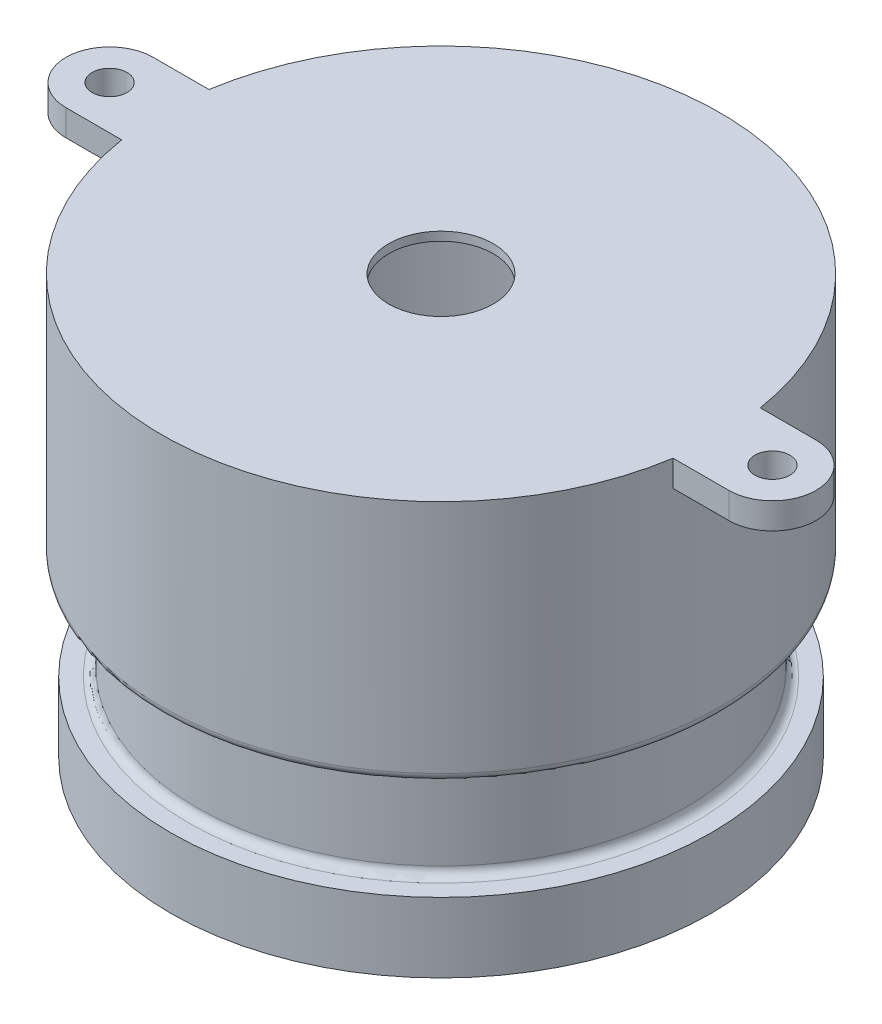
SolidWorks part; units mm, degrees
ref_plane "Front" through (0, 0, 0) normal (0, 0, 1) x (1, 0, 0)
ref_plane "Top" through (0, 0, 0) normal (0, 1, 0) x (1, 0, 0)
ref_plane "Right" through (0, 0, 0) normal (1, 0, 0) x (0, 0, -1)
sketch "Sketch1" plane through (0, 0, 0) normal (0, 0, 1) x (1, 0, 0)
  line L0 (0, 0) -> (0, 12.7) construction
  line L1 (0, 0) -> (-50.8, 0)
  line L2 (-50.8, 0) -> (-50.8, -44.45)
  line L3 (-50.8, -44.45) -> (-44.45, -44.45)
  line L4 (-44.45, -44.45) -> (-44.45, -63.5)
  line L5 (-44.45, -63.5) -> (-49.2125, -63.5)
  line L6 (-49.2125, -63.5) -> (-49.2125, -76.2)
  line L7 (-49.2125, -76.2) -> (0, -76.2)
  line L8 (0, -76.2) -> (0, 0)
  dimension "D1" = 101.6
  dimension "D2" = 44.45
  dimension "D3" = 76.2
  dimension "D4" = 12.7
  dimension "D5" = 88.9
  dimension "D6" = 98.425
revolve "Revolve1" add sketch "Sketch1" angle 360 about L0
fillet "Fillet1" radius 1.5875 3 edges at (0, -44.45, -50.8) (0, -44.45, -44.45) (0, -63.5, -44.45)
shell "Shell1" thickness 1.5875
sketch "Sketch2" plane through (0, 0, 0) normal (0, 1, 0) x (-1, 0, 0)
  line L0 (0, 0) -> (63.5, 0) construction
  line L1 (0, 0) -> (0, -25.4) construction
  line L2 (50.1761, -7.9375) -> (60.325, -7.9375)
  line L3 (60.325, 7.9375) -> (50.1761, 7.9375)
  line L4 (-60.325, 7.9375) -> (-50.1761, 7.9375)
  line L5 (-50.1761, -7.9375) -> (-60.325, -7.9375)
  circle A0 centre (0, 0) radius 50.8 construction
  arc A1 (50.1761, -7.9375) -> (50.1761, 7.9375) centre (0, 0) ccw
  arc A2 (60.325, -7.9375) -> (60.325, 7.9375) centre (60.325, 0) ccw
  circle A3 centre (60.325, 0) radius 3.175
  circle A4 centre (-60.325, 0) radius 3.175
  arc A5 (-60.325, -7.9375) -> (-60.325, 7.9375) centre (-60.325, 0) cw
  arc A6 (-50.1761, -7.9375) -> (-50.1761, 7.9375) centre (0, 0) cw
  dimension "D1" = 15.875
  dimension "D2" = 136.525
  dimension "D3" = 6.35
extrude "Extrude1" add sketch "Sketch2" against normal blind 4.7625
fillet "Fillet2" radius 0.7937 1 edges at (0, -65.0875, -47.625)
sketch "Sketch3" plane through (0, 0, 0) normal (0, 1, 0) x (-1, 0, 0)
  circle A0 centre (0, 0) radius 9.525
  dimension "D1" = 19.05
extrude "Cut-Extrude1" cut sketch "Sketch3" against normal through all
